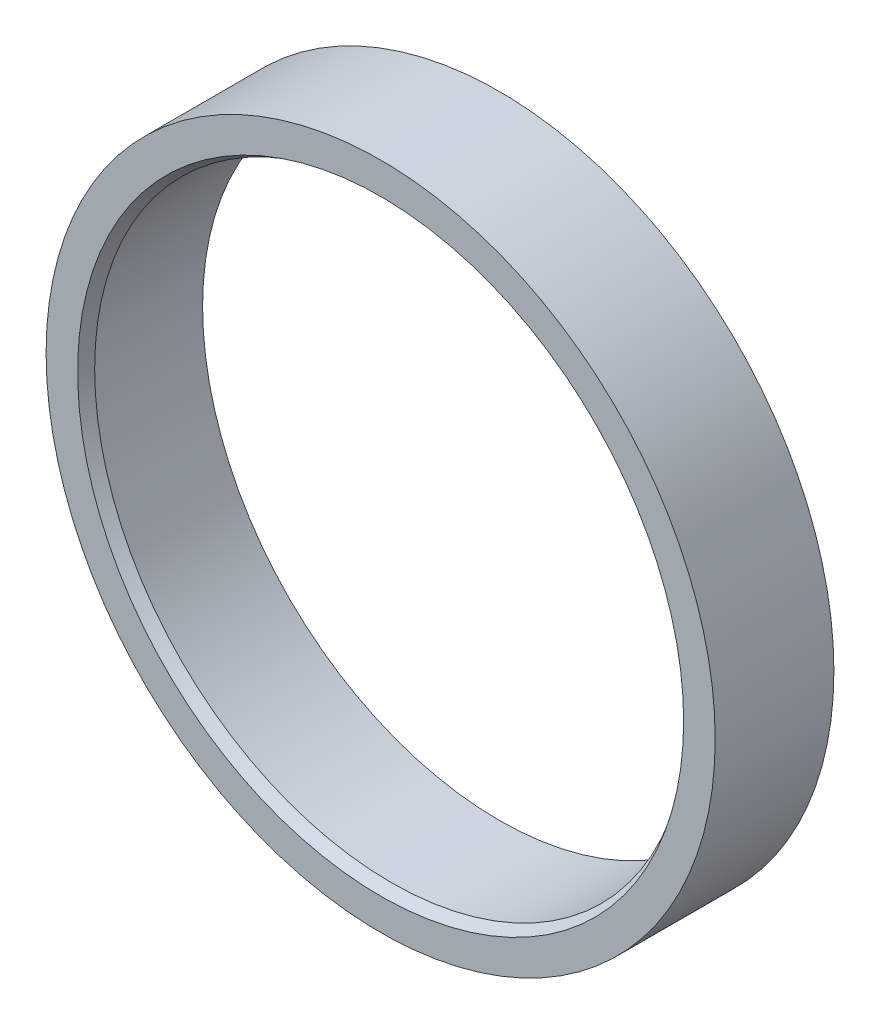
SolidWorks part; units mm, degrees
ref_plane "Plan de face" through (0, 0, 0) normal (0, 0, 1) x (1, 0, 0)
ref_plane "Plan de dessus" through (0, 0, 0) normal (0, 1, 0) x (1, 0, 0)
ref_plane "Plan de droite" through (0, 0, 0) normal (1, 0, 0) x (0, 0, -1)
sketch "Esquisse1" plane through (0, 0, 0) normal (1, 0, 0) x (0, 0, -1)
  line L0 (0, 0) -> (75.9836, 0) construction
  line L1 (1, 27.5) -> (11, 27.5)
  line L2 (11, 27.5) -> (11, 31)
  line L3 (11, 31) -> (0, 31)
  line L4 (0, 31) -> (0, 28.0774)
  line L5 (0, 28.0774) -> (1, 27.5)
  point P3 (0, 27.5)
  dimension "D1" = 1
  dimension "D2" = 30
  dimension "D3" = 11
  dimension "D4" = 55
  dimension "D5" = 62
revolve "Révolution1" add sketch "Esquisse1" angle 360 about L0
